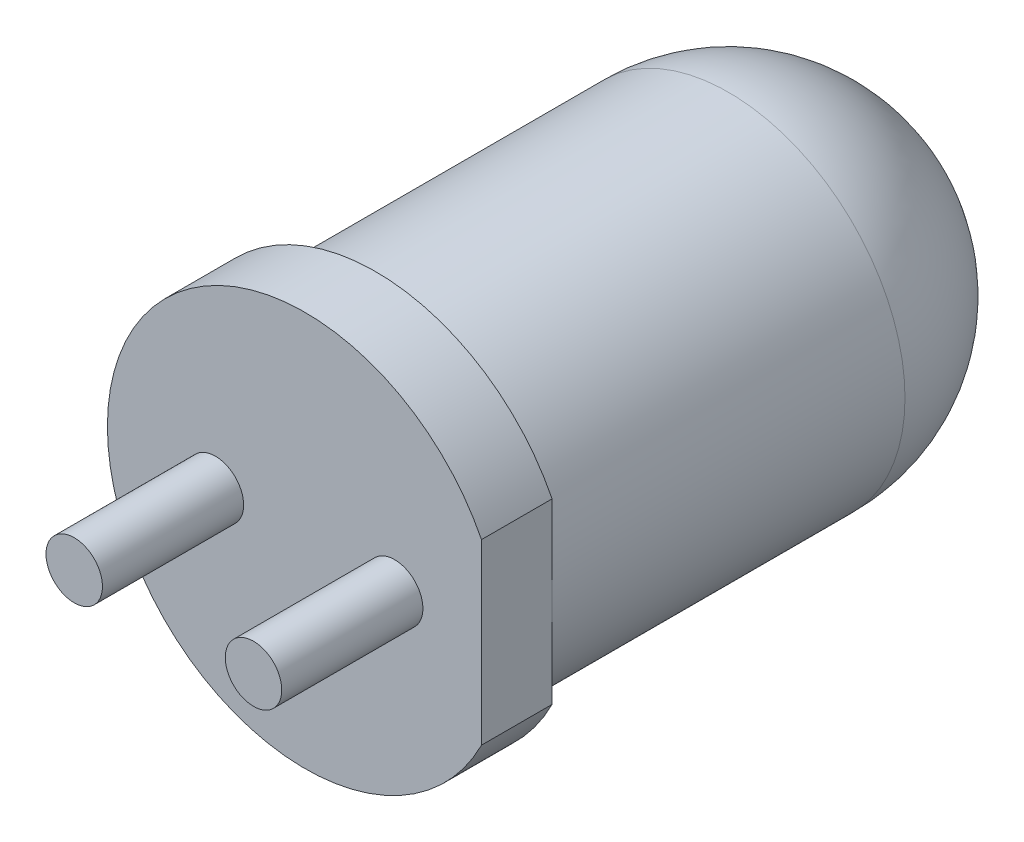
SolidWorks part; units mm, degrees
ref_plane "Face" through (0, 0, 0) normal (0, 0, 1) x (1, 0, 0)
ref_plane "Dessus" through (0, 0, 0) normal (0, 1, 0) x (1, 0, 0)
ref_plane "Droite" through (0, 0, 0) normal (1, 0, 0) x (0, 0, -1)
sketch "Esquisse1" plane through (0, 0, 0) normal (0, 0, 1) x (1, 0, 0)
  circle A0 centre (0, 0) radius 2.5
extrude "Base-Extrusion" add sketch "Esquisse1" along normal blind 8.5
sketch "Esquisse2" plane through (0, 0, 8.5) normal (0, 0, 1) x (1, 0, 0)
  line L0 (2.5, -2.4917) -> (2.5, 2.5621) construction
  line L1 (2.5, 1.261) -> (2.5, -1.261)
  arc A0 (2.5, 1.261) -> (2.5, -1.261) centre (0, 0) ccw
extrude "Boss.-Extru.1" add sketch "Esquisse2" against normal blind 1
fillet "Congé1" radius 2.5 1 edges at (2.5, 0, 0)
sketch "Esquisse4" plane through (0, 0, 8.5) normal (0, 0, 1) x (1, 0, 0)
  line L0 (0, 3.1135) -> (0, -3.252) construction
  line L1 (3.4099, 0) -> (-4.0101, 0) construction
  line L2 (1.27, 2.6978) -> (1.27, -3.252) construction
  circle A0 centre (1.27, 0) radius 0.4
  circle A1 centre (-1.27, 0) radius 0.4
  dimension "D1" = 1.27
extrude "Extrusion1" add sketch "Esquisse4" along normal blind 2
